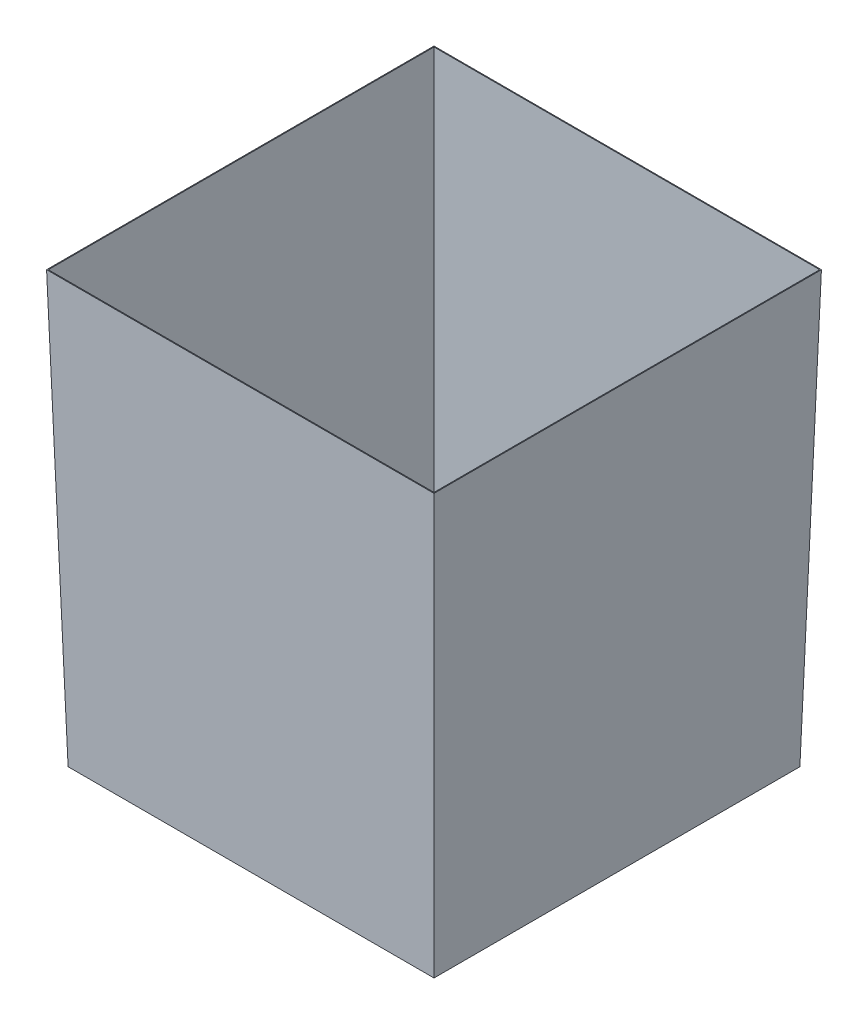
SolidWorks part; units mm, degrees
ref_plane "Спереди" through (0, 0, 0) normal (0, 0, 1) x (1, 0, 0)
ref_plane "Сверху" through (0, 0, 0) normal (0, 1, 0) x (1, 0, 0)
ref_plane "Справа" through (0, 0, 0) normal (1, 0, 0) x (0, 0, -1)
other "Configuration Table"
sketch "Эскиз1" plane through (0, 0, 0) normal (0, 1, 0) x (1, 0, 0)
  line L1 (-425, -425) -> (425, -425)
  line L2 (-425, -425) -> (-425, 425)
  line L3 (-425, 425) -> (425, 425)
  line L4 (425, -425) -> (425, 425)
ref_plane "Плоскость1" through (0, 1000, 0) normal (0, 1, 0) x (1, 0, 0)
sketch "Эскиз2" plane through (0, 1000, 0) normal (0, 1, 0) x (1, 0, 0)
  line L1 (-450, -450) -> (450, -450)
  line L2 (-450, -450) -> (-450, 450)
  line L3 (-450, 450) -> (450, 450)
  line L4 (450, -450) -> (450, 450)
loft "Корпус 850-900, H1000" add profiles "Эскиз1", "Эскиз2"
shell "Стенка и дно 2 мм" thickness 2
